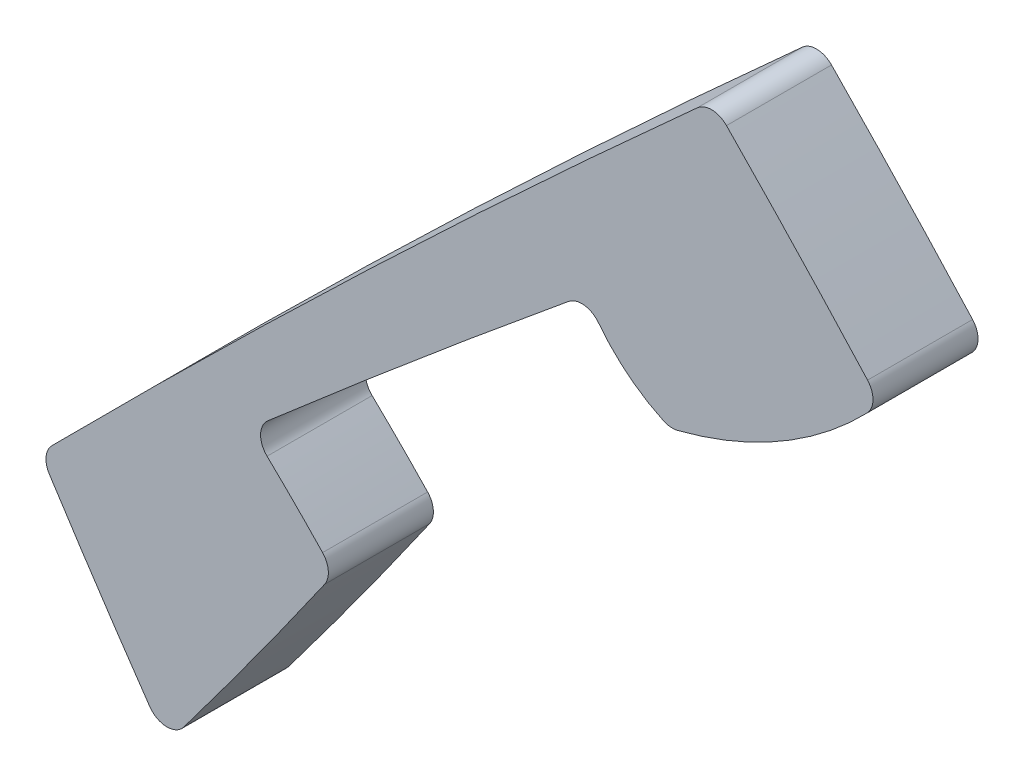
SolidWorks part; units mm, degrees
ref_plane "Ebene vorne" through (0, 0, 0) normal (0, 0, 1) x (1, 0, 0)
ref_plane "Ebene oben" through (0, 0, 0) normal (0, 1, 0) x (1, 0, 0)
ref_plane "Ebene rechts" through (0, 0, 0) normal (1, 0, 0) x (0, 0, -1)
sketch "Skizze1" plane through (0, 0, 0) normal (0, 0, 1) x (1, 0, 0)
  line L0 (0, 11.7087) -> (0, 0) construction
  line L1 (0, 0) -> (8.7585, 0) construction
  line L2 (2.8, 2.2) -> (1.2, 0) construction
  line L3 (2.8, 2.2) -> (2, 3) construction
  line L4 (2, 3) -> (5.2, 5.7) construction
  line L5 (5.2, 5.7) -> (6, 5) construction
  line L6 (1.2, 0) -> (0, 1.8) construction
  line L8 (8, 6.2) -> (6.4, 7.9) construction
  line L9 (0, 1.8) -> (6.4, 7.9) construction
  arc A0 (0, 1.8) -> (6.4, 7.9) centre (103.3183, -100.1922) cw
  arc A1 (1.2, 0) -> (0, 1.8) centre (41.5101, 28.1734) cw
  arc A2 (2.8, 2.2) -> (1.2, 0) centre (-45.9519, 35.9741) cw
  arc A3 (2.8, 2.2) -> (2, 3) centre (-8.5365, -8.3365) ccw
  arc A4 (2, 3) -> (5.2, 5.7) centre (88.7338, -96.5493) cw
  arc A5 (8, 6.2) -> (6, 5) centre (5.1257, 8.7238) cw
  arc A6 (8, 6.2) -> (6.4, 7.9) centre (-30.4828, -28.4161) ccw
  arc A7 (6, 5) -> (5.2, 5.7) centre (6.6448, 6.5441) cw
  point P0 (1.2, 0)
  point P1 (2.8, 2.2)
  point P2 (2, 3)
  point P3 (6, 5)
  point P4 (5.2, 5.7)
  point P5 (8, 6.2)
  point P6 (6.4, 7.9)
  point P7 (0, 1.8)
  dimension "D1" = 1.2
  dimension "D2" = 2
  dimension "D3" = 3
  dimension "D4" = 2.8
  dimension "D5" = 2.2
  dimension "D6" = 5.2
  dimension "D7" = 5.7
  dimension "D8" = 5
  dimension "D9" = 6
  dimension "D10" = 1.8
  dimension "D11" = 8
  dimension "D12" = 6.2
  dimension "D13" = 7.9
  dimension "D14" = 6.4
extrude "Linear austragen1" add sketch "Skizze1" along normal blind 1
fillet "Verrundung1" radius 0.2 8 edges at (0, 1.8, 0.5) (6.4, 7.9, 0.5) (8, 6.2, 0.5) (6, 5, 0.5) (5.2, 5.7, 0.5) (2, 3, 0.5) (2.8, 2.2, 0.5) (1.2, 0, 0.5)
